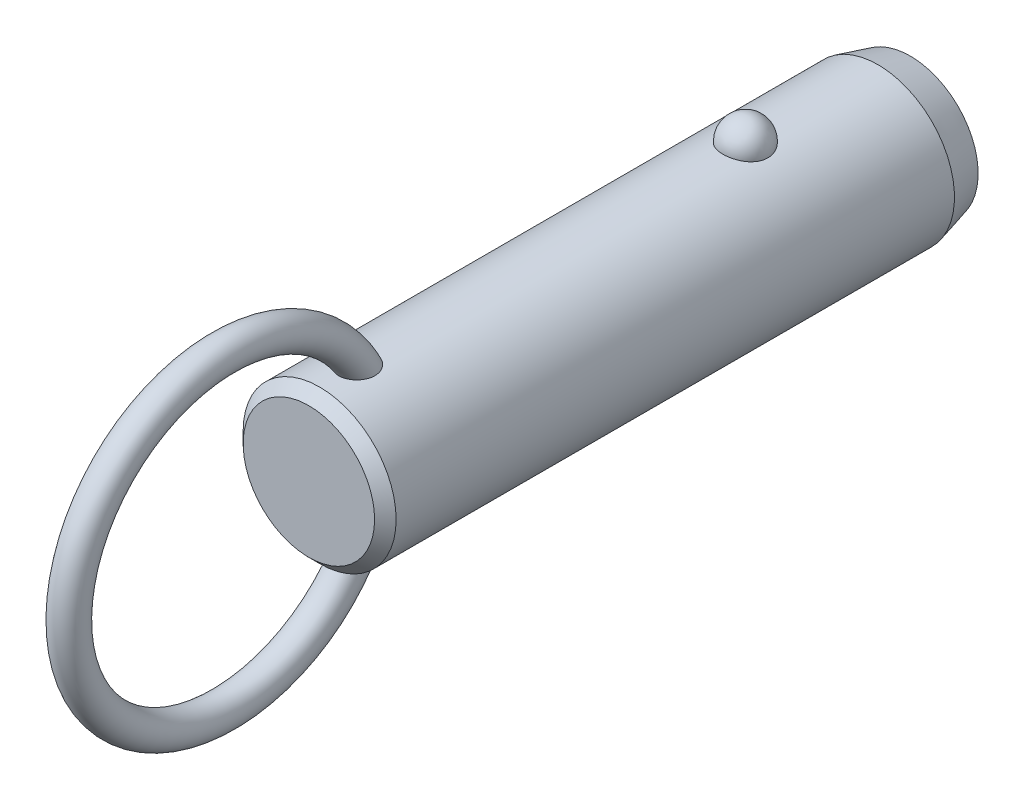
SolidWorks part; units mm, degrees
ref_plane "Front Plane" through (0, 0, 0) normal (0, 0, 1) x (1, 0, 0)
ref_plane "Top Plane" through (0, 0, 0) normal (0, 1, 0) x (1, 0, 0)
ref_plane "Right Plane" through (0, 0, 0) normal (1, 0, 0) x (0, 0, -1)
sketch "Sketch2" plane through (0, 0, 0) normal (0, 0, 1) x (1, 0, 0)
  circle A0 centre (0, 0) radius 7.1
  point P3 (0, 7.1)
  dimension "D1" = 14.2
extrude "Boss-Extrude1" add sketch "Sketch2" along normal blind 30.5
sketch "Sketch3" plane through (0, 0, 0) normal (0, 0, -1) x (-1, 0, 0)
  circle A0 centre (0, 0) radius 7.1
  dimension "D1" = 14.2
extrude "Boss-Extrude2" add sketch "Sketch3" along normal blind 17.4
chamfer "Chamfer1" distance 3 angle 15 1 edges at (-7.1, 0, -17.4)
sketch "Sketch12" plane through (0, 0, 0) normal (1, 0, 0) x (0, 0, -1)
  line L0 (-30.5, 7.1) -> (-30.5, -7.1) construction
  point P0 (-30.5, 0)
sketch "Sketch13" plane through (0, 0, 0) normal (1, 0, 0) x (0, 0, -1)
  circle A0 centre (-46.35, 0) radius 15.85
  point P2 (-30.5, 0)
  dimension "D1" = 31.7
sketch "Sketch14" plane through (0, 0, 0) normal (0, 1, 0) x (1, 0, 0)
  circle A0 centre (0, -32) radius 1.5
  point P2 (0, -30.5)
  dimension "D1" = 3
sweep "Sweep1" add profiles "Sketch14" path "Sketch13"
sketch "Sketch15" plane through (0, 0, 30.5) normal (0, 0, 1) x (1, 0, 0)
  circle A0 centre (0, 0) radius 7.1
  dimension "D1" = 14.2
extrude "Boss-Extrude3" add sketch "Sketch15" along normal blind 7.92
chamfer "Chamfer2" distance 1 angle 45 1 edges at (7.1, 0, 38.42)
sketch "Sketch18" plane through (0, 0, 0) normal (1, 0, 0) x (0, 0, -1)
  line L0 (14.4, 7.1) -> (-32.1792, 7.1) construction
  line L1 (2.1, 9.2) -> (2.1, 5)
  line L2 (-32.1792, -7.1) -> (14.4, -7.1) construction
  arc A0 (2.1, 9.2) -> (2.1, 5) centre (2.1, 7.1) ccw
  point P4 (0, 7.1)
  dimension "D1" = 16.3
revolve "Revolve1" add sketch "Sketch18" angle 360 about L1
